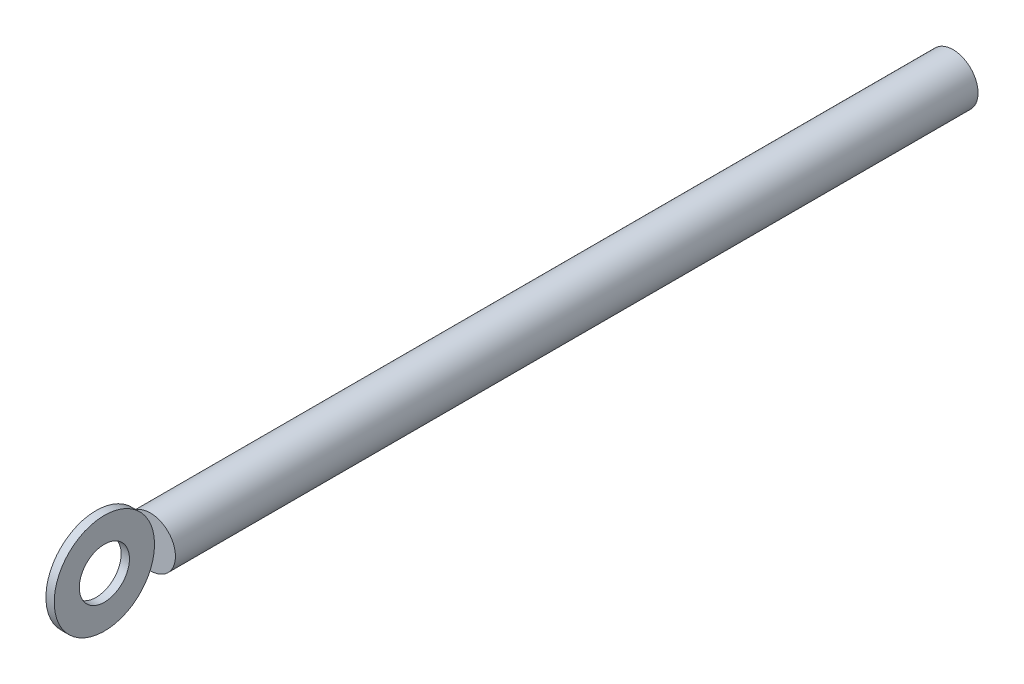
SolidWorks part; units mm, degrees
ref_plane "Front" through (0, 0, 0) normal (0, 0, 1) x (1, 0, 0)
ref_plane "Top" through (0, 0, 0) normal (0, 1, 0) x (1, 0, 0)
ref_plane "Right" through (0, 0, 0) normal (1, 0, 0) x (0, 0, -1)
sketch "Sketch1" plane through (0, 0, 0) normal (0, 0, 1) x (1, 0, 0)
  circle A0 centre (0, 0) radius 4.7625
  dimension "D1" = 9.525
extrude "Extrude1" add sketch "Sketch1" along normal mid plane 152.4
sketch "Sketch2" plane through (0, 0, 0) normal (1, 0, 0) x (0, 0, -1)
  circle A0 centre (-85.725, 0) radius 9.525
  dimension "D1" = 19.05
  dimension "D2" = 85.725
extrude "Extrude2" add sketch "Sketch2" along normal mid plane 1.5748
sketch "Sketch3" plane through (-0.7874, 0, 0) normal (-1, 0, 0) x (0, 0, 1)
  circle A0 centre (85.725, 0) radius 4.7625
  dimension "D1" = 9.525
  dimension "D2" = 85.725
extrude "Cut-Extrude1" cut sketch "Sketch3" against normal through all
